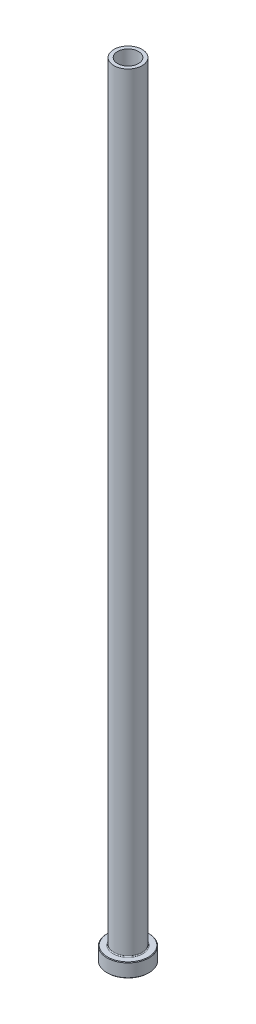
SolidWorks part; units mm, degrees
ref_plane "Front Plane" through (0, 0, 0) normal (0, 0, 1) x (1, 0, 0)
ref_plane "Top Plane" through (0, 0, 0) normal (0, 1, 0) x (1, 0, 0)
ref_plane "Right Plane" through (0, 0, 0) normal (1, 0, 0) x (0, 0, -1)
sketch "Sketch1" plane through (0, 0, 0) normal (0, 0, 1) x (1, 0, 0)
  line L0 (0, 0) -> (0, 50000) construction
  line L1 (0, 0) -> (9.525, 0)
  line L2 (9.525, 0) -> (9.525, 6.35)
  line L3 (9.525, 6.35) -> (6.804, 6.35)
  line L4 (6.4072, 6.7469) -> (6.4072, 355.6)
  line L5 (6.4072, 355.6) -> (0, 355.6)
  line L6 (0, 355.6) -> (0, 0)
  arc A0 (6.4072, 6.7469) -> (6.804, 6.35) centre (6.804, 6.7469) ccw
  dimension "D5" = 0.3969
  dimension "D1" = 12.8143
  dimension "D2" = 19.05
  dimension "D3" = 6.35
  dimension "D4" = 355.6
revolve "Revolve1" add sketch "Sketch1" angle 360 about L0
sketch "Sketch2" plane through (0, 0, 0) normal (0, 0, 1) x (1, 0, 0)
  line L0 (0, 0) -> (0, 50000) construction
  line L1 (-9.525, 0) -> (9.525, 0) construction
  line L2 (5.3499, 0) -> (4.953, 0.3969)
  line L3 (4.953, 0.3969) -> (4.953, 281.1145)
  line L4 (4.953, 281.1145) -> (4.7625, 295.402)
  line L5 (4.7625, 295.402) -> (4.7625, 355.6)
  line L6 (6.4072, 355.6) -> (-6.4072, 355.6) construction
  line L7 (4.7625, 355.6) -> (0, 355.6)
  line L8 (0, 355.6) -> (0, 0)
  line L9 (0, 0) -> (5.3499, 0)
  point P4 (0, 0)
  dimension "D1" = 0.3969
  dimension "D2" = 45
  dimension "D3" = 9.525
  dimension "D4" = 9.906
  dimension "D5" = 60.198
  dimension "D6" = 14.2875
revolve "Cut-Revolve1" cut sketch "Sketch2" angle 360 about L0
chamfer "Chamfer1" distance 0.254 angle 45 2 edges at (0, 0, -9.525) (0, 6.35, -9.525)
